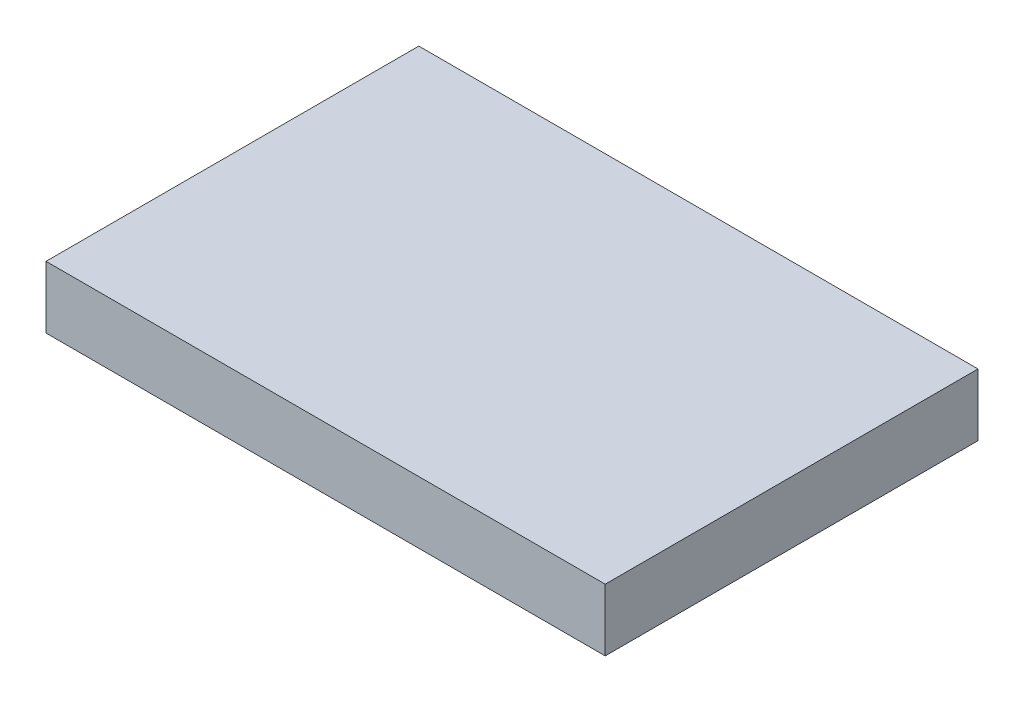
SolidWorks part; units mm, degrees
ref_plane "Front Plane" through (0, 0, 0) normal (0, 0, 1) x (1, 0, 0)
ref_plane "Top Plane" through (0, 0, 0) normal (0, 1, 0) x (1, 0, 0)
ref_plane "Right Plane" through (0, 0, 0) normal (1, 0, 0) x (0, 0, -1)
sketch "Sketch1" plane through (0, 0, 0) normal (0, 1, 0) x (1, 0, 0)
  line L1 (0, 0) -> (180, 0)
  line L2 (0, 0) -> (0, 120)
  line L3 (0, 120) -> (180, 120)
  line L4 (180, 0) -> (180, 120)
  dimension "D1" = 180
  dimension "D2" = 120
extrude "Extrude1" add sketch "Sketch1" along normal blind 20
